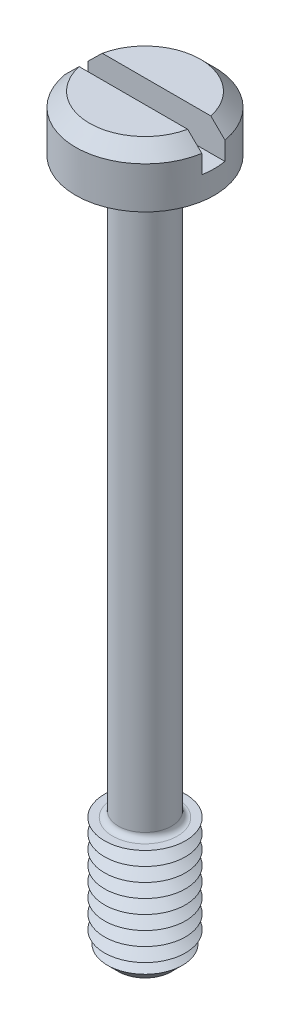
SolidWorks part; units mm, degrees
ref_plane "Front Plane" through (0, 0, 0) normal (0, 0, 1) x (1, 0, 0)
ref_plane "Top Plane" through (0, 0, 0) normal (0, 1, 0) x (1, 0, 0)
ref_plane "Right Plane" through (0, 0, 0) normal (1, 0, 0) x (0, 0, -1)
sketch "Sketch1" plane through (0, 0, 0) normal (0, 1, 0) x (1, 0, 0)
  circle A0 centre (0, 0) radius 3
  dimension "D1" = 6
extrude "Boss-Extrude1" add sketch "Sketch1" along normal blind 2.4
sketch "Sketch2" plane through (0, 0, 0) normal (0, -1, 0) x (1, 0, 0)
  circle A0 centre (0, 0) radius 1.15
  dimension "D1" = 2.3
extrude "Boss-Extrude2" add sketch "Sketch2" along normal blind 30
sketch "Sketch3" plane through (0, -30, 0) normal (0, -1, 0) x (1, 0, 0)
  circle A0 centre (0, 0) radius 1.75
  dimension "D1" = 3.5
extrude "Boss-Extrude3" add sketch "Sketch3" against normal blind 5.2
chamfer "Chamfer1" distance 0.6 angle 45 1 edges at (0, -30, -1.75)
sketch "Sketch4" plane through (0, 0, 0) normal (1, 0, 0) x (0, 0, -1)
  line L0 (0, -6.5871) -> (0, -12.0372) construction
sketch "Sketch5" plane through (0, 0, 0) normal (1, 0, 0) x (0, 0, -1)
  line L0 (-1.75, -24.8) -> (-1.2304, -25.1)
  line L1 (-1.2304, -25.1) -> (-1.75, -25.4)
  line L2 (-1.75, -24.8) -> (-1.75, -29.4) construction
  line L3 (-1.75, -25.4) -> (-1.75, -24.8)
  dimension "D1" = 0.6
revolve "Cut-Revolve1" cut sketch "Sketch5" angle 360 about L0
pattern_linear "LPattern1" count 8 spacing 0.6 along (0, -1, 0) of "Cut-Revolve1"
fillet "Fillet1" radius 0.25 2 edges at (0, -24.8, -1.15) (0, 0, -1.15)
chamfer "Chamfer2" distance 0.6 angle 45 1 edges at (0, 2.4, 3)
sketch "Sketch6" plane through (0, 2.4, 0) normal (0, 1, 0) x (1, 0, 0)
  line L1 (3, -0.5) -> (-3, -0.5)
  line L2 (3, -0.5) -> (3, 0.5)
  line L3 (3, 0.5) -> (-3, 0.5)
  line L4 (-3, -0.5) -> (-3, 0.5)
  line L5 (3, -0.5) -> (-3, 0.5) construction
  line L6 (3, 0.5) -> (-3, -0.5) construction
  circle A0 centre (0, 0) radius 3 construction
  point P0 (0, 0)
  dimension "D1" = 1
extrude "Cut-Extrude1" cut sketch "Sketch6" against normal blind 1.4
